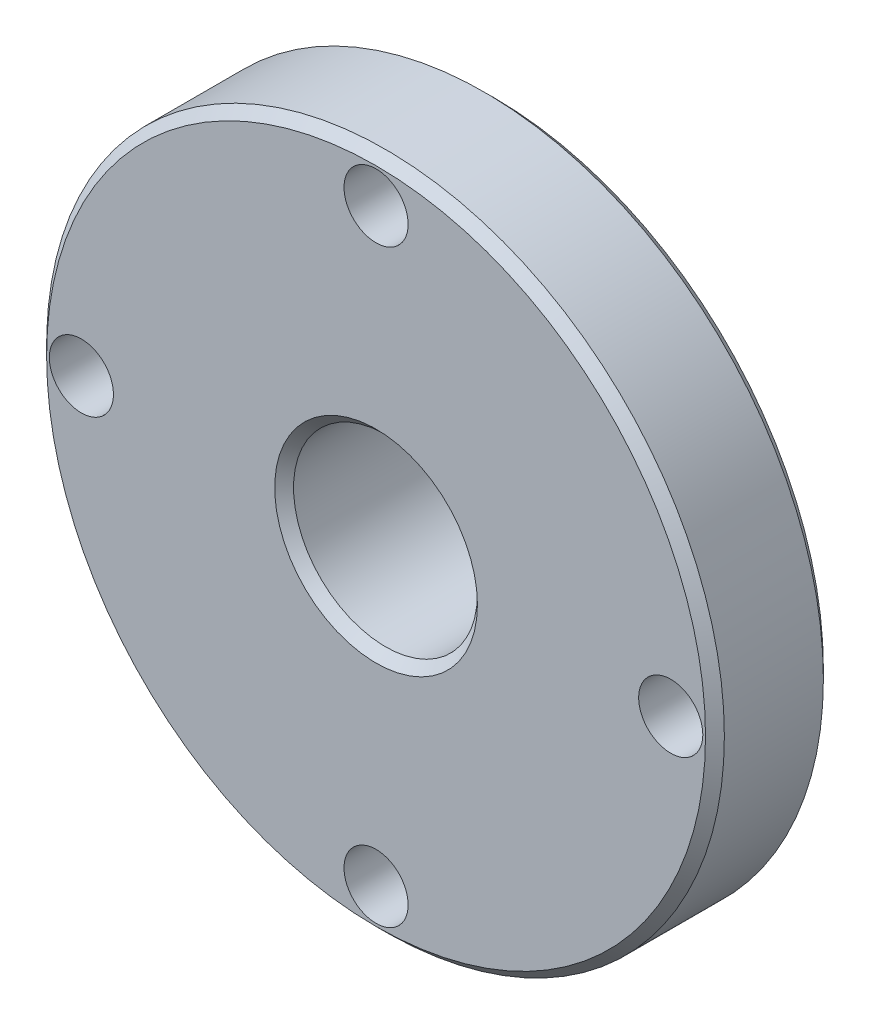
SolidWorks part; units mm, degrees
ref_plane "Front" through (0, 0, 0) normal (0, 0, 1) x (1, 0, 0)
ref_plane "Top" through (0, 0, 0) normal (0, 1, 0) x (1, 0, 0)
ref_plane "Right" through (0, 0, 0) normal (1, 0, 0) x (0, 0, -1)
sketch "Sketch1" plane through (0, 0, 0) normal (0, 0, 1) x (1, 0, 0)
  circle A0 centre (0, 0) radius 18.2562 construction
  circle A1 centre (0, 0) radius 18.2562
extrude "Extrude1" add sketch "Sketch1" along normal blind 6.35
sketch "Sketch2" plane through (0, 0, 6.35) normal (0, 0, 1) x (1, 0, 0)
  circle A0 centre (0, 15.875) radius 1.7272
  circle A1 centre (-15.875, 0) radius 1.7272
  circle A2 centre (0, -15.875) radius 1.7272
  circle A3 centre (15.875, 0) radius 1.7272
  dimension "D1" = 3.4544
  dimension "D2" = 3.4544
  dimension "D3" = 3.4544
  dimension "D4" = 3.4544
extrude "screw holes" cut sketch "Sketch2" against normal blind 6.35
sketch "Sketch3" plane through (0, 0, 6.35) normal (0, 0, 1) x (1, 0, 0)
  circle A0 centre (0, 0) radius 4.953
  dimension "D1" = 9.906
extrude "conn hole" cut sketch "Sketch3" against normal through all
sketch "Sketch4" plane through (0, 0, 0) normal (0, 0, -1) x (-1, 0, 0)
  circle A0 centre (0, 0) radius 9.4615
  circle A1 centre (0, 0) radius 4.953 construction
  circle A2 centre (0, 0) radius 4.953
  dimension "D1" = 18.923
extrude "locator boss" add sketch "Sketch4" along normal blind 2.032
chamfer "edges" distance 0.508 angle 45
